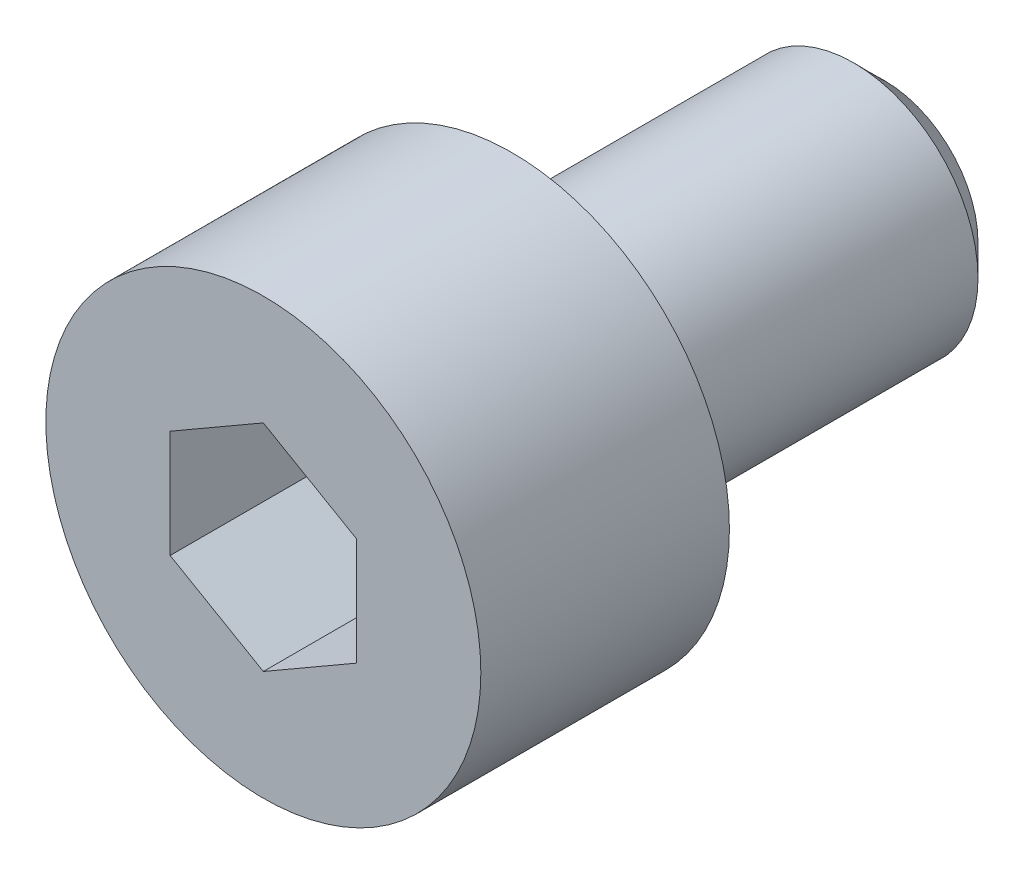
SolidWorks part; units mm, degrees
ref_plane "Front" through (0, 0, 0) normal (0, 0, 1) x (1, 0, 0)
ref_plane "Top" through (0, 0, 0) normal (0, 1, 0) x (1, 0, 0)
ref_plane "Right" through (0, 0, 0) normal (1, 0, 0) x (0, 0, -1)
sketch "Sketch1" plane through (0, 0, 0) normal (0, 0, 1) x (1, 0, 0)
  circle A0 centre (0, 0) radius 3.5
  dimension "D1" = 7
extrude "Base-Extrude" add sketch "Sketch1" against normal blind 4
sketch "Sketch2" plane through (0, 0, -4) normal (0, 0, -1) x (-1, 0, 0)
  circle A0 centre (0, 0) radius 2
  circle A1 centre (0, 0) radius 3.5 construction
  dimension "D1" = 4
extrude "Boss-Extrude1" add sketch "Sketch2" along normal blind 6
sketch "Sketch3" plane through (0, 0, 0) normal (0, 0, 1) x (1, 0, 0)
  line L0 (0, -3.85) -> (0, 3.85) construction
  line L1 (1.5, -0.866) -> (1.5, 0.866)
  line L2 (1.5, 0.866) -> (0, 1.7321)
  line L3 (0, 1.7321) -> (-1.5, 0.866)
  line L4 (-1.5, 0.866) -> (-1.5, -0.866)
  line L5 (-1.5, -0.866) -> (0, -1.7321)
  line L6 (0, -1.7321) -> (1.5, -0.866)
  circle A0 centre (0, 0) radius 1.5 construction
  dimension "D1" = 3
extrude "Cut-Extrude1" cut sketch "Sketch3" against normal blind 4
chamfer "Chamfer1" distance 0.5 angle 45 1 edges at (-2, 0, -10)
